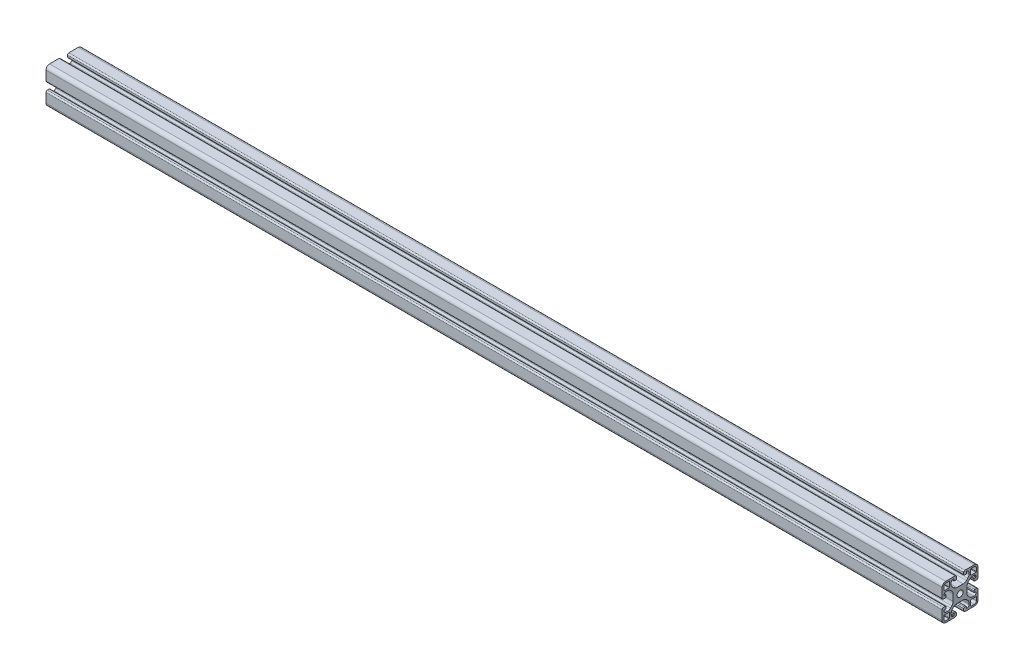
SolidWorks part; units mm, degrees
ref_plane "Ebene vorne" through (0, 0, 0) normal (0, 0, 1) x (1, 0, 0)
ref_plane "Ebene oben" through (0, 0, 0) normal (0, 1, 0) x (1, 0, 0)
ref_plane "Ebene rechts" through (0, 0, 0) normal (1, 0, 0) x (0, 0, -1)
sketch "Skizze1" plane through (0, 0, 0) normal (0, 1, 0) x (1, 0, 0)
  line L0 (0, 0) -> (1000, 0)
  dimension "D1" = 1000
other "Strukturbauteil1"
ref_plane "Ebene1" through (0, 0, 0) normal (1, 0, 0) x (0, 0, -1)
sketch "Model" plane through (0, 0, 0) normal (1, 0, 0) x (0, 0, -1)
  line L0 (11.8, 12.3) -> (11.8, 17.7)
  line L1 (12.3, 18.2) -> (16, 18.2)
  line L2 (18.2, 16) -> (18.2, 12.3)
  line L3 (17.7, 11.8) -> (12.3, 11.8)
  line L4 (-16, -20) -> (-5.5, -20)
  line L5 (-4, -18.5) -> (-4, -16.5)
  line L6 (-5, -15.5) -> (-6.5, -15.5)
  line L7 (-7, -16) -> (-7, -17.59)
  line L8 (-10, -15.5) -> (-10, -14.1924)
  line L9 (-8.5355, -10.6569) -> (-7.0931, -9.2145)
  line L10 (-3.5576, -7.75) -> (3.5576, -7.75)
  line L11 (7.0931, -9.2145) -> (8.5355, -10.6569)
  line L12 (10, -14.1924) -> (10, -15.5)
  line L13 (7, -17.59) -> (7, -16)
  line L14 (6.5, -15.5) -> (5, -15.5)
  line L15 (4, -16.5) -> (4, -18.5)
  line L16 (5.5, -20) -> (16, -20)
  line L17 (20, -16) -> (20, -5.5)
  line L18 (18.5, -4) -> (16.5, -4)
  line L19 (15.5, -5) -> (15.5, -6.5)
  line L20 (16, -7) -> (17.59, -7)
  line L21 (15.5, -10) -> (14.1924, -10)
  line L22 (10.6569, -8.5355) -> (9.2145, -7.0931)
  line L23 (7.75, -3.5576) -> (7.75, 3.5576)
  line L24 (9.2145, 7.0931) -> (10.6569, 8.5355)
  line L25 (14.1924, 10) -> (15.5, 10)
  line L26 (17.59, 7) -> (16, 7)
  line L27 (15.5, 6.5) -> (15.5, 5)
  line L28 (16.5, 4) -> (18.5, 4)
  line L29 (20, 5.5) -> (20, 16)
  line L30 (16, 20) -> (5.5, 20)
  line L31 (4, 18.5) -> (4, 16.5)
  line L32 (5, 15.5) -> (6.5, 15.5)
  line L33 (7, 16) -> (7, 17.59)
  line L34 (10, 15.5) -> (10, 14.1924)
  line L35 (8.5355, 10.6569) -> (7.0931, 9.2145)
  line L36 (3.5576, 7.75) -> (-3.5576, 7.75)
  line L37 (-7.0931, 9.2145) -> (-8.5355, 10.6569)
  line L38 (-10, 14.1924) -> (-10, 15.5)
  line L39 (-7, 17.59) -> (-7, 16)
  line L40 (-6.5, 15.5) -> (-5, 15.5)
  line L41 (-4, 16.5) -> (-4, 18.5)
  line L42 (-5.5, 20) -> (-16, 20)
  line L43 (-20, 16) -> (-20, 5.5)
  line L44 (-18.5, 4) -> (-16.5, 4)
  line L45 (-15.5, 5) -> (-15.5, 6.5)
  line L46 (-16, 7) -> (-17.59, 7)
  line L47 (-15.5, 10) -> (-14.1924, 10)
  line L48 (-10.6569, 8.5355) -> (-9.2145, 7.0931)
  line L49 (-7.75, 3.5576) -> (-7.75, -3.5576)
  line L50 (-9.2145, -7.0931) -> (-10.6569, -8.5355)
  line L51 (-14.1924, -10) -> (-15.5, -10)
  line L52 (-17.59, -7) -> (-16, -7)
  line L53 (-15.5, -6.5) -> (-15.5, -5)
  line L54 (-16.5, -4) -> (-18.5, -4)
  line L55 (-20, -5.5) -> (-20, -16)
  line L56 (-18.2, 16) -> (-18.2, 12.3)
  line L57 (-17.7, 11.8) -> (-12.3, 11.8)
  line L58 (-11.8, 12.3) -> (-11.8, 17.7)
  line L59 (-12.3, 18.2) -> (-16, 18.2)
  line L60 (-18.2, -16) -> (-18.2, -12.3)
  line L61 (-17.7, -11.8) -> (-12.3, -11.8)
  line L62 (-11.8, -12.3) -> (-11.8, -17.7)
  line L63 (-12.3, -18.2) -> (-16, -18.2)
  line L64 (12.3, -18.2) -> (16, -18.2)
  line L65 (18.2, -16) -> (18.2, -12.3)
  line L66 (17.7, -11.8) -> (12.3, -11.8)
  line L67 (11.8, -12.3) -> (11.8, -17.7)
  line L68 (-7.5, 18) -> (-7.41, 18)
  line L69 (-20, -20) -> (20, -20) construction
  line L70 (-20, -20) -> (-20, 20) construction
  line L71 (-20, 20) -> (20, 20) construction
  line L72 (20, -20) -> (20, 20) construction
  line L73 (-20, -20) -> (20, 20) construction
  line L74 (-20, 20) -> (20, -20) construction
  line L75 (-18, 7.5) -> (-18, 7.41)
  line L76 (7.5, 18) -> (7.41, 18)
  line L77 (18, 7.5) -> (18, 7.41)
  line L78 (18, -7.5) -> (18, -7.41)
  line L79 (7.5, -18) -> (7.41, -18)
  line L80 (-7.5, -18) -> (-7.41, -18)
  line L81 (-18, -7.5) -> (-18, -7.41)
  circle A0 centre (0, 0) radius 3.4
  arc A1 (12.3, 18.2) -> (11.8, 17.7) centre (12.3, 17.7) ccw
  arc A2 (18.2, 16) -> (16, 18.2) centre (16, 16) ccw
  arc A3 (17.7, 11.8) -> (18.2, 12.3) centre (17.7, 12.3) ccw
  arc A4 (11.8, 12.3) -> (12.3, 11.8) centre (12.3, 12.3) ccw
  arc A5 (-5.5, -20) -> (-4, -18.5) centre (-5.5, -18.5) ccw
  arc A6 (-4, -16.5) -> (-5, -15.5) centre (-5, -16.5) ccw
  arc A7 (-6.5, -15.5) -> (-7, -16) centre (-6.5, -16) ccw
  arc A8 (-18, -7.41) -> (-17.59, -7) centre (-17.59, -7.41) cw
  arc A9 (-10, -15.5) -> (-7.5, -18) centre (-7.5, -15.5) ccw
  arc A10 (-8.5355, -10.6569) -> (-10, -14.1924) centre (-5, -14.1924) ccw
  arc A11 (-3.5576, -7.75) -> (-7.0931, -9.2145) centre (-3.5576, -12.75) ccw
  arc A12 (7.0931, -9.2145) -> (3.5576, -7.75) centre (3.5576, -12.75) ccw
  arc A13 (10, -14.1924) -> (8.5355, -10.6569) centre (5, -14.1924) ccw
  arc A14 (7.5, -18) -> (10, -15.5) centre (7.5, -15.5) ccw
  arc A15 (-7.41, -18) -> (-7, -17.59) centre (-7.41, -17.59) ccw
  arc A16 (7, -16) -> (6.5, -15.5) centre (6.5, -16) ccw
  arc A17 (5, -15.5) -> (4, -16.5) centre (5, -16.5) ccw
  arc A18 (4, -18.5) -> (5.5, -20) centre (5.5, -18.5) ccw
  arc A19 (16, -20) -> (20, -16) centre (16, -16) ccw
  arc A20 (20, -5.5) -> (18.5, -4) centre (18.5, -5.5) ccw
  arc A21 (16.5, -4) -> (15.5, -5) centre (16.5, -5) ccw
  arc A22 (15.5, -6.5) -> (16, -7) centre (16, -6.5) ccw
  arc A23 (7.41, -18) -> (7, -17.59) centre (7.41, -17.59) cw
  arc A24 (15.5, -10) -> (18, -7.5) centre (15.5, -7.5) ccw
  arc A25 (10.6569, -8.5355) -> (14.1924, -10) centre (14.1924, -5) ccw
  arc A26 (7.75, -3.5576) -> (9.2145, -7.0931) centre (12.75, -3.5576) ccw
  arc A27 (9.2145, 7.0931) -> (7.75, 3.5576) centre (12.75, 3.5576) ccw
  arc A28 (14.1924, 10) -> (10.6569, 8.5355) centre (14.1924, 5) ccw
  arc A29 (18, 7.5) -> (15.5, 10) centre (15.5, 7.5) ccw
  arc A30 (18, -7.41) -> (17.59, -7) centre (17.59, -7.41) ccw
  arc A31 (16, 7) -> (15.5, 6.5) centre (16, 6.5) ccw
  arc A32 (15.5, 5) -> (16.5, 4) centre (16.5, 5) ccw
  arc A33 (18.5, 4) -> (20, 5.5) centre (18.5, 5.5) ccw
  arc A34 (20, 16) -> (16, 20) centre (16, 16) ccw
  arc A35 (5.5, 20) -> (4, 18.5) centre (5.5, 18.5) ccw
  arc A36 (4, 16.5) -> (5, 15.5) centre (5, 16.5) ccw
  arc A37 (6.5, 15.5) -> (7, 16) centre (6.5, 16) ccw
  arc A38 (18, 7.41) -> (17.59, 7) centre (17.59, 7.41) cw
  arc A39 (10, 15.5) -> (7.5, 18) centre (7.5, 15.5) ccw
  arc A40 (8.5355, 10.6569) -> (10, 14.1924) centre (5, 14.1924) ccw
  arc A41 (3.5576, 7.75) -> (7.0931, 9.2145) centre (3.5576, 12.75) ccw
  arc A42 (-7.0931, 9.2145) -> (-3.5576, 7.75) centre (-3.5576, 12.75) ccw
  arc A43 (-10, 14.1924) -> (-8.5355, 10.6569) centre (-5, 14.1924) ccw
  arc A44 (-7.5, 18) -> (-10, 15.5) centre (-7.5, 15.5) ccw
  arc A45 (-18, 7.41) -> (-17.59, 7) centre (-17.59, 7.41) ccw
  arc A46 (-7, 16) -> (-6.5, 15.5) centre (-6.5, 16) ccw
  arc A47 (-5, 15.5) -> (-4, 16.5) centre (-5, 16.5) ccw
  arc A48 (-4, 18.5) -> (-5.5, 20) centre (-5.5, 18.5) ccw
  arc A49 (-16, 20) -> (-20, 16) centre (-16, 16) ccw
  arc A50 (-20, 5.5) -> (-18.5, 4) centre (-18.5, 5.5) ccw
  arc A51 (-16.5, 4) -> (-15.5, 5) centre (-16.5, 5) ccw
  arc A52 (-15.5, 6.5) -> (-16, 7) centre (-16, 6.5) ccw
  arc A53 (7.41, 18) -> (7, 17.59) centre (7.41, 17.59) ccw
  arc A54 (-15.5, 10) -> (-18, 7.5) centre (-15.5, 7.5) ccw
  arc A55 (-10.6569, 8.5355) -> (-14.1924, 10) centre (-14.1924, 5) ccw
  arc A56 (-7.75, 3.5576) -> (-9.2145, 7.0931) centre (-12.75, 3.5576) ccw
  arc A57 (-9.2145, -7.0931) -> (-7.75, -3.5576) centre (-12.75, -3.5576) ccw
  arc A58 (-14.1924, -10) -> (-10.6569, -8.5355) centre (-14.1924, -5) ccw
  arc A59 (-18, -7.5) -> (-15.5, -10) centre (-15.5, -7.5) ccw
  arc A61 (-16, -7) -> (-15.5, -6.5) centre (-16, -6.5) ccw
  arc A62 (-15.5, -5) -> (-16.5, -4) centre (-16.5, -5) ccw
  arc A63 (-18.5, -4) -> (-20, -5.5) centre (-18.5, -5.5) ccw
  arc A64 (-20, -16) -> (-16, -20) centre (-16, -16) ccw
  arc A65 (-16, 18.2) -> (-18.2, 16) centre (-16, 16) ccw
  arc A66 (-18.2, 12.3) -> (-17.7, 11.8) centre (-17.7, 12.3) ccw
  arc A67 (-12.3, 11.8) -> (-11.8, 12.3) centre (-12.3, 12.3) ccw
  arc A68 (-11.8, 17.7) -> (-12.3, 18.2) centre (-12.3, 17.7) ccw
  arc A69 (-17.7, -11.8) -> (-18.2, -12.3) centre (-17.7, -12.3) ccw
  arc A70 (-11.8, -12.3) -> (-12.3, -11.8) centre (-12.3, -12.3) ccw
  arc A71 (-12.3, -18.2) -> (-11.8, -17.7) centre (-12.3, -17.7) ccw
  arc A72 (-18.2, -16) -> (-16, -18.2) centre (-16, -16) ccw
  arc A73 (16, -18.2) -> (18.2, -16) centre (16, -16) ccw
  arc A74 (18.2, -12.3) -> (17.7, -11.8) centre (17.7, -12.3) ccw
  arc A75 (12.3, -11.8) -> (11.8, -12.3) centre (12.3, -12.3) ccw
  arc A76 (11.8, -17.7) -> (12.3, -18.2) centre (12.3, -17.7) ccw
  arc A77 (-7.41, 18) -> (-7, 17.59) centre (-7.41, 17.59) cw
  point P171 (0, 0)
  point P222 (0, 20)
  point P223 (0, -20)
  point P224 (20, 0)
  point P225 (-20, 0)
  dimension "D1" = 40
  dimension "D2" = 40
